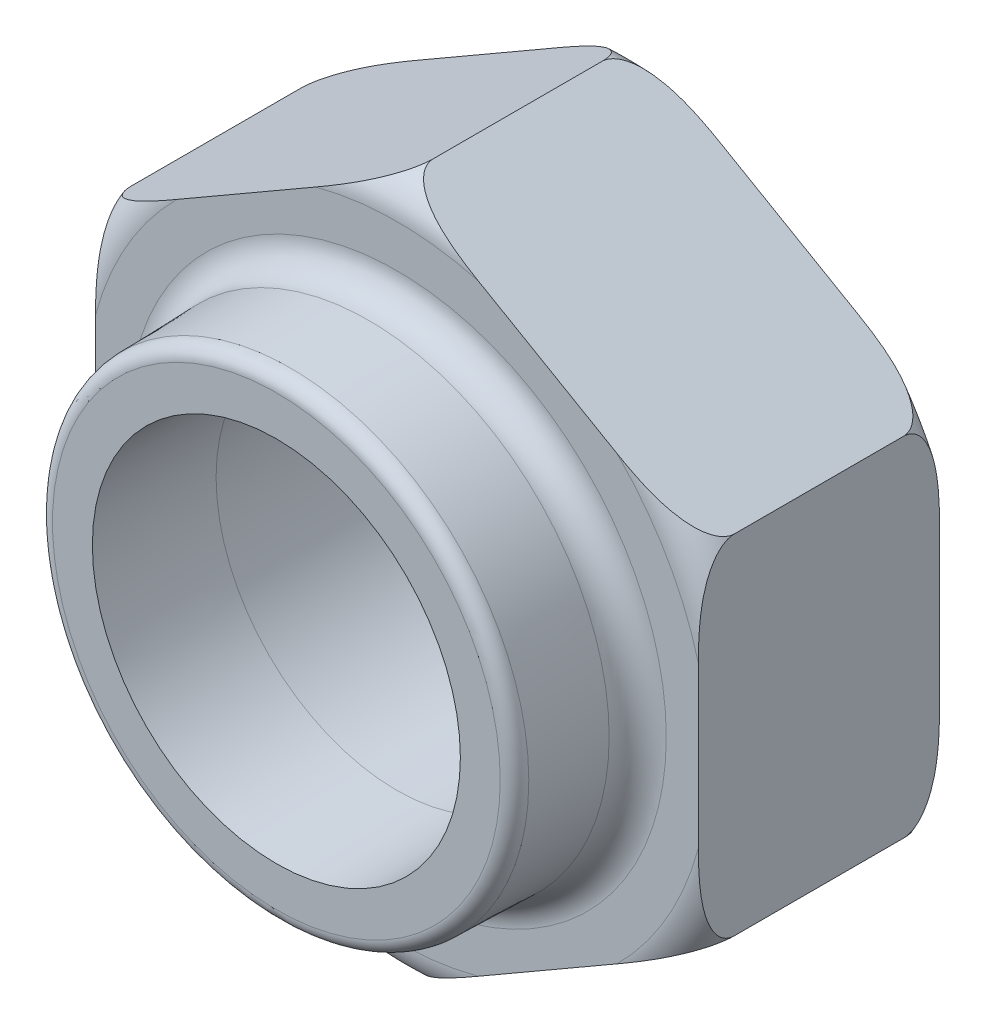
SolidWorks part; units mm, degrees
ref_plane "Face" through (0, 0, 0) normal (0, 0, 1) x (1, 0, 0)
ref_plane "Gauche" through (0, 0, 0) normal (0, 1, 0) x (1, 0, 0)
ref_plane "Dessus" through (0, 0, 0) normal (1, 0, 0) x (0, 0, -1)
sketch "Esquisse1" plane through (0, 0, 0) normal (0, 0, 1) x (1, 0, 0)
  line L0 (0, 0) -> (-49.3312, 0) construction
  line L1 (0, 0) -> (0, -43.0886) construction
  line L2 (-5, 2.8868) -> (-5, -2.8868)
  line L3 (5, 2.8868) -> (5, -2.8868)
  line L4 (-5, -2.8868) -> (0, -5.7735)
  line L5 (5, -2.8868) -> (0, -5.7735)
  line L7 (-5, 2.8868) -> (0, 5.7735)
  line L9 (5, 2.8868) -> (0, 5.7735)
  point P14 (-5, 0)
  point P17 (5, 0)
  dimension "D1" = 10
  dimension "A" = 10
  dimension "D3" = 10
  dimension "D4" = 30
extrude "Tete" add sketch "Esquisse1" along normal blind 4
sketch "Esquisse2" plane through (0, 0, 0) normal (1, 0, 0) x (0, 0, -1)
  line L0 (0, 0) -> (-68.4114, 0) construction
  line L1 (0, -2.8868) -> (0, -5.7735) construction
  line L2 (-4, -5.7735) -> (0, -5.7735) construction
  line L3 (-0.6, -5.7735) -> (-0.6, -15.7735)
  line L4 (8.7711, -15.7735) -> (-0.6, -15.7735)
  line L5 (0, -5.1735) -> (8.7711, -5.1735)
  line L7 (8.7711, -5.1735) -> (8.7711, -15.7735)
  arc A0 (-0.6, -5.7735) -> (0, -5.1735) centre (-0.6, -5.1735) ccw
  dimension "R" = 0.6
  dimension "D2" = 8.7711
  dimension "D3" = 10
revolve "Rayon de tete" cut sketch "Esquisse2" angle 360 about L0
ref_plane "Plan1" through (0, 0, 2) normal (0, 0, 1) x (1, 0, 0)
mirror "Symétrie1" about plane through (0, 0, 2) normal (0, 0, 1) of "Rayon de tete"
sketch "Esquisse3" plane through (0, 0, 0) normal (0, 0, -1) x (-1, 0, 0)
  circle A0 centre (0, 0) radius 3
  dimension "D" = 6
extrude "Enlèv. de mat.-Extru.1" cut sketch "Esquisse3" against normal through all
sketch "Esquisse4" plane through (0, 0, 4) normal (0, 0, 1) x (1, 0, 0)
  circle A0 centre (0, 0) radius 4
  circle A1 centre (0, 0) radius 3 construction
  circle A2 centre (0, 0) radius 3
  dimension "Dn" = 8
extrude "Boss.-Extru.1" add sketch "Esquisse4" along normal blind 2 draft 1.5
fillet "Congé1" radius 0.48 1 edges at (4, 0, 4)
fillet "Congé3" radius 0.24 1 edges at (3.9476, 0, 6)
equation "\"D1@Esquisse1\" = \"A@Esquisse1\""
equation "\"D3@Esquisse1\" = \"A@Esquisse1\""
equation "\"D1@Plan1\" = \"B@Tete\"/2"
equation "\"Dn@Esquisse4\" = \"D@Esquisse3\"+ \"D@Esquisse3\"/3"
equation "\"Ra@Congé1\" = \"R@Esquisse2\"*0.8"
equation "\"D1@Congé3\" = \"Ra@Congé1\"/2"
